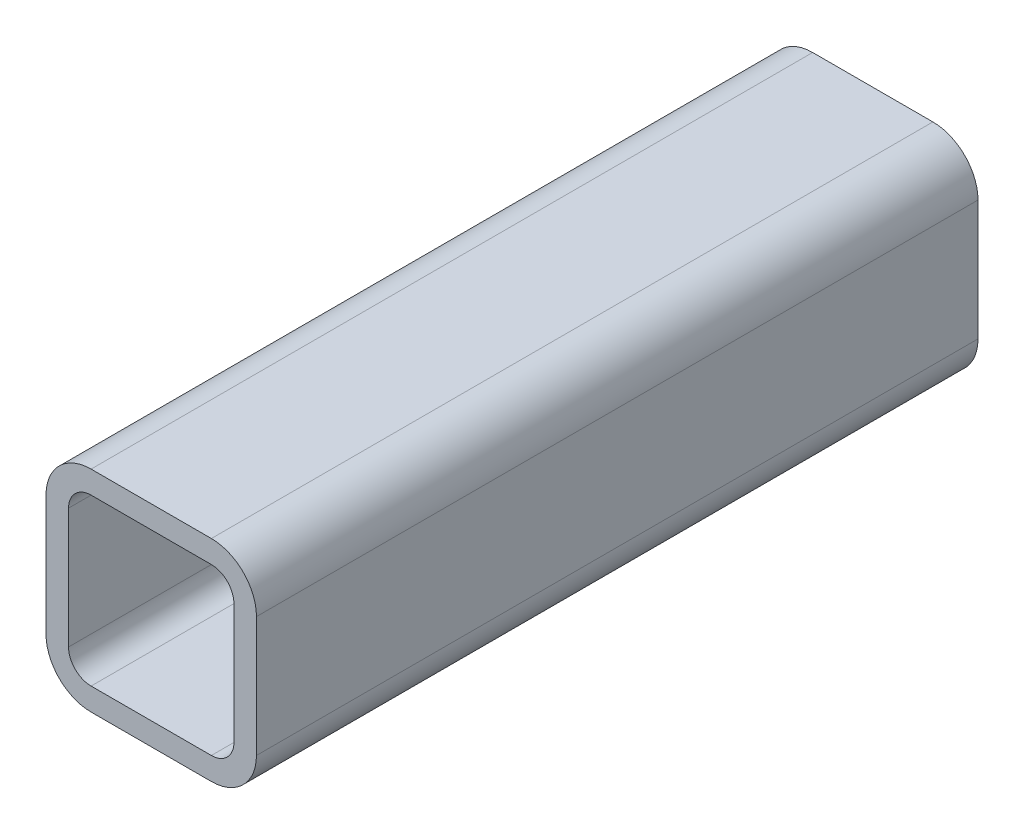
SolidWorks part; units mm, degrees
ref_plane "Front Plane" through (0, 0, 0) normal (0, 0, 1) x (1, 0, 0)
ref_plane "Top Plane" through (0, 0, 0) normal (0, 1, 0) x (1, 0, 0)
ref_plane "Right Plane" through (0, 0, 0) normal (1, 0, 0) x (0, 0, -1)
sketch "Sketch1" plane through (0, 0, 0) normal (0, 0, 1) x (1, 0, 0)
sketch_block_instance "HSS3.5x3.5x0.375-1"
sketch_block "HSS3.5x3.5x0.375"
extrude "Boss-Extrude1" add sketch "Sketch1" along normal blind 304.8
